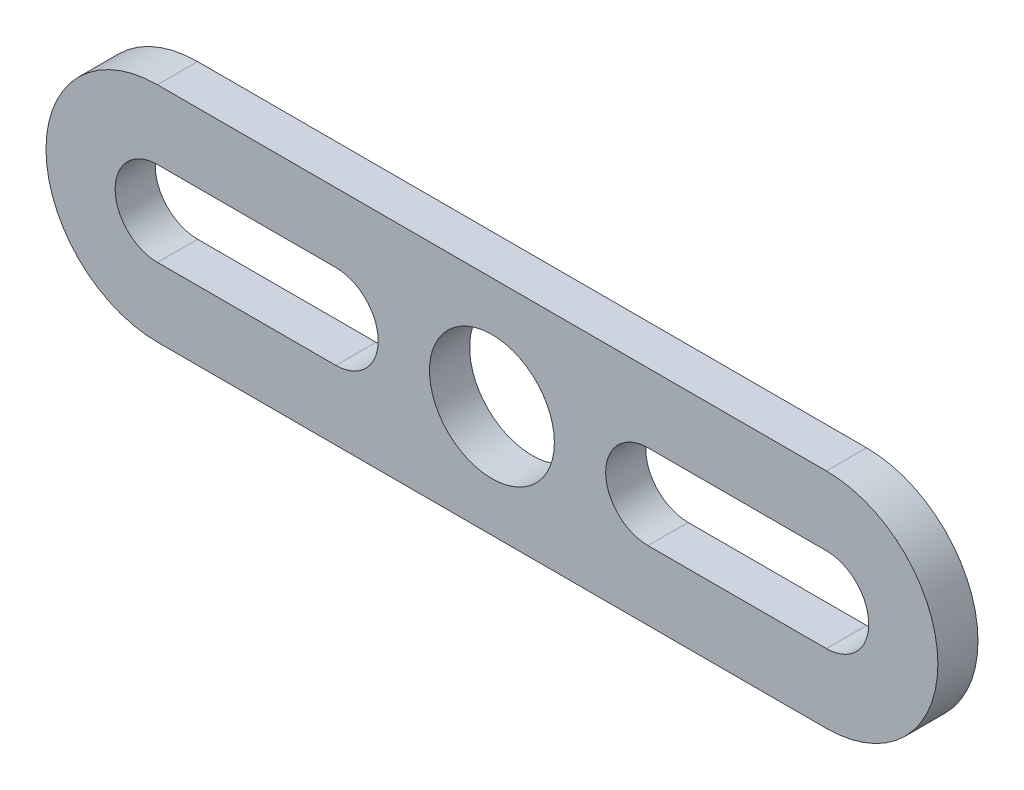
SolidWorks part; units mm, degrees
ref_plane "Front" through (0, 0, 0) normal (0, 0, 1) x (1, 0, 0)
ref_plane "Top" through (0, 0, 0) normal (0, 1, 0) x (1, 0, 0)
ref_plane "Right" through (0, 0, 0) normal (1, 0, 0) x (0, 0, -1)
sketch "Sketch1" plane through (0, 0, 0) normal (0, 0, 1) x (1, 0, 0)
  line L0 (19.05, -6.35) -> (-19.05, 6.35) construction
  line L1 (-19.05, -6.35) -> (19.05, -6.35)
  line L3 (-19.05, 6.35) -> (19.05, 6.35)
  arc A0 (19.05, 6.35) -> (19.05, -6.35) centre (19.05, 0) cw
  arc A1 (-19.05, -6.35) -> (-19.05, 6.35) centre (-19.05, 0) cw
  dimension "D2" = 6.35
  dimension "D1" = 38.1
extrude "Extrude1" add sketch "Sketch1" along normal blind 2.286
sketch "Sketch2" plane through (0, 0, 2.286) normal (0, 0, 1) x (1, 0, 0)
  line L1 (8.89, 2.413) -> (19.05, 2.413)
  line L3 (8.89, -2.413) -> (19.05, -2.413)
  arc A0 (19.05, 2.413) -> (19.05, -2.413) centre (19.05, 0) cw
  arc A1 (8.89, 2.413) -> (8.89, -2.413) centre (8.89, 0) ccw
  dimension "D2" = 4.826
  dimension "D3" = 8.89
  dimension "D1" = 10.16
extrude "Slot Cut" cut sketch "Sketch2" against normal through all
mirror "Mirror1" about plane through (0, 0, 0) normal (1, 0, 0) of "Slot Cut"
sketch "Sketch3" plane through (0, 0, 2.286) normal (0, 0, 1) x (1, 0, 0)
  circle A0 centre (0, 0) radius 3.556
  dimension "D1" = 7.112
extrude "Hole-Center" cut sketch "Sketch3" against normal through all
